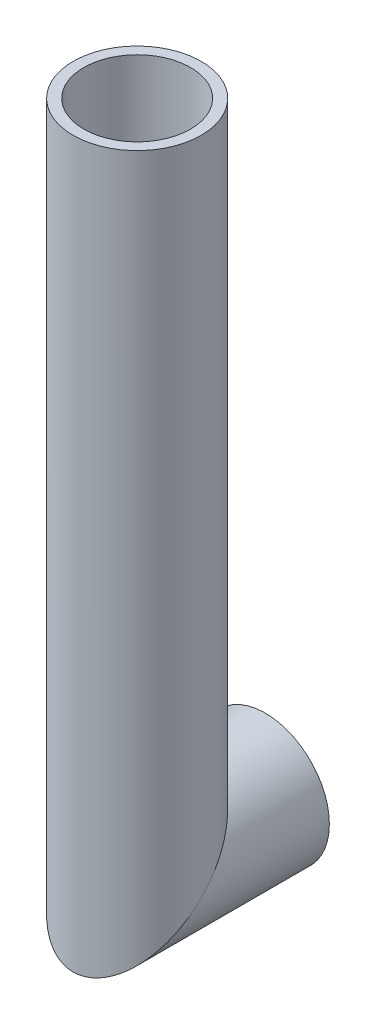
SolidWorks part; units mm, degrees
ref_plane "Alzado" through (0, 0, 0) normal (0, 0, 1) x (1, 0, 0)
ref_plane "Planta" through (0, 0, 0) normal (0, 1, 0) x (1, 0, 0)
ref_plane "Vista lateral" through (0, 0, 0) normal (1, 0, 0) x (0, 0, -1)
sketch "Croquis2" plane through (0, 0, 0) normal (0, 0, 1) x (1, 0, 0)
  circle A0 centre (0, 0) radius 6
  circle A1 centre (0, 0) radius 5
  dimension "D1" = 12
  dimension "D2" = 10
sketch "Croquis4" plane through (0, 0, 0) normal (1, 0, 0) x (0, 0, -1)
sketch "Croquis13" plane through (0, 0, 0) normal (1, 0, 0) x (0, 0, -1)
  line L0 (0, 0) -> (-12, 0)
  line L1 (-12, 0) -> (-12, 61.86)
  dimension "D1" = 12
  dimension "D2" = 61.86
sweep "Barrer6" add profiles "Croquis2" path "Croquis13"
